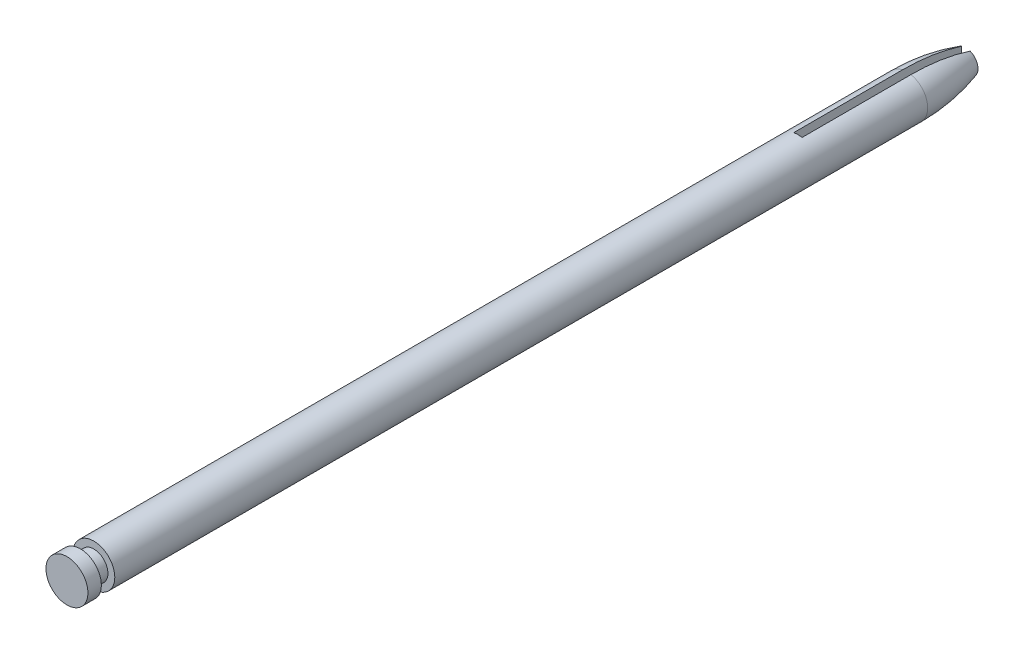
SolidWorks part; units mm, degrees
ref_plane "Спереди" through (0, 0, 0) normal (0, 0, 1) x (1, 0, 0)
ref_plane "Сверху" through (0, 0, 0) normal (0, 1, 0) x (1, 0, 0)
ref_plane "Справа" through (0, 0, 0) normal (1, 0, 0) x (0, 0, -1)
sketch "Эскиз1" plane through (0, 0, 0) normal (1, 0, 0) x (0, 0, -1)
  line L0 (0, 0) -> (97.8951, 0) construction
  line L1 (84.9313, 0) -> (0, 0)
  line L2 (0, 0) -> (0, 1.9812)
  line L3 (0, 1.9812) -> (1.27, 1.9812)
  line L4 (1.27, 1.9812) -> (1.27, 1.3335)
  line L5 (1.27, 1.3335) -> (2.54, 1.3335)
  line L6 (2.54, 1.3335) -> (2.54, 1.9812)
  line L7 (2.54, 1.9812) -> (79.3432, 1.9812)
  line L8 (84.9313, 0) -> (84.9313, 1.1432)
  arc A0 (79.3432, 1.9812) -> (84.9313, 1.1432) centre (79.3432, -17.0688) cw
  dimension "D3" = 19.05
  dimension "D1" = 2.667
  dimension "D2" = 3.9624
  dimension "D4" = 5.588
  dimension "D5" = 84.9313
  dimension "D6" = 1.27
  dimension "D7" = 1.27
revolve "Повернуть1" add sketch "Эскиз1" angle 360 about L0
sketch "Эскиз2" plane through (0, 0, 0) normal (0, 1, 0) x (1, 0, 0)
  line L0 (0, 0) -> (0, 100.2232) construction
  line L1 (-0.3969, 84.9313) -> (0.3969, 84.9313)
  line L2 (-0.3969, 84.9313) -> (-0.3969, 69.0563)
  line L3 (-0.3969, 69.0563) -> (0.3969, 69.0563)
  line L4 (0.3969, 84.9313) -> (0.3969, 69.0563)
  line L5 (1.1432, 84.9313) -> (-1.1432, 84.9313) construction
  dimension "D1" = 0.7937
  dimension "D2" = 15.875
extrude "Вырез-Вытянуть1" cut sketch "Эскиз2" against normal mid plane 5.08
